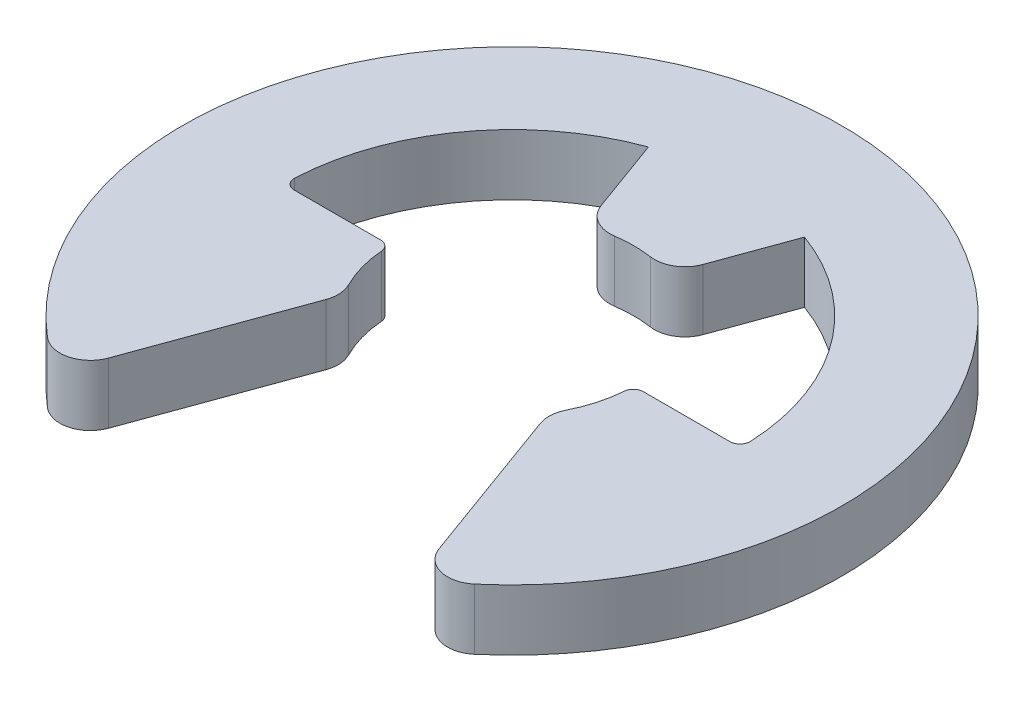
SolidWorks part; units mm, degrees
ref_plane "Front Plane" through (0, 0, 0) normal (0, 0, 1) x (1, 0, 0)
ref_plane "Top Plane" through (0, 0, 0) normal (0, 1, 0) x (1, 0, 0)
ref_plane "Right Plane" through (0, 0, 0) normal (1, 0, 0) x (0, 0, -1)
sketch "Sketch2" plane through (0, 0, 0) normal (0, 1, 0) x (1, 0, 0)
  line L0 (-0.8835, -1.3639) -> (-0.505, -0.324)
  line L2 (0.505, -0.324) -> (0.8835, -1.3639)
  line L4 (-0.6, 0) -> (-1.125, 0)
  line L5 (0.6, 0) -> (1.125, 0)
  line L6 (-0.3848, 1.0572) -> (-0.2052, 0.5638)
  line L8 (0.2052, 0.5638) -> (0.3848, 1.0572)
  arc A0 (0.8835, -1.3639) -> (-0.8835, -1.3639) centre (0, 0) ccw
  arc A1 (0.505, -0.324) -> (0.6, 0) centre (0, 0) ccw
  arc A2 (1.125, 0) -> (0.3848, 1.0572) centre (0, 0) ccw
  arc A3 (-0.6, 0) -> (-0.505, -0.324) centre (0, 0) ccw
  arc A4 (0.2052, 0.5638) -> (-0.2052, 0.5638) centre (0, 0) ccw
  arc A5 (-0.3848, 1.0572) -> (-1.125, 0) centre (0, 0) ccw
  point P15 (0, 0)
  point P16 (0, 0.6)
  dimension "D1" = 3.25
  dimension "D2" = 1.2
  dimension "D3" = 2.25
  dimension "D4" = 70
  dimension "D5" = 70
  dimension "D6" = 1.01
  dimension "D7" = 40
extrude "Boss-Extrude1" add sketch "Sketch2" along normal mid plane 0.3
fillet "Fillet1" radius 0.15 6 edges at (0.505, 0, 0.324) (-0.505, 0, 0.324) (0.2052, 0, -0.5638) (-0.2052, 0, -0.5638) (0.8835, 0, 1.3639) (-0.8835, 0, 1.3639)
fillet "Fillet2" radius 0.05 4 edges at (1.125, 0, 0) (0.6, 0, 0) (-1.125, 0, 0) (-0.6, 0, 0)
